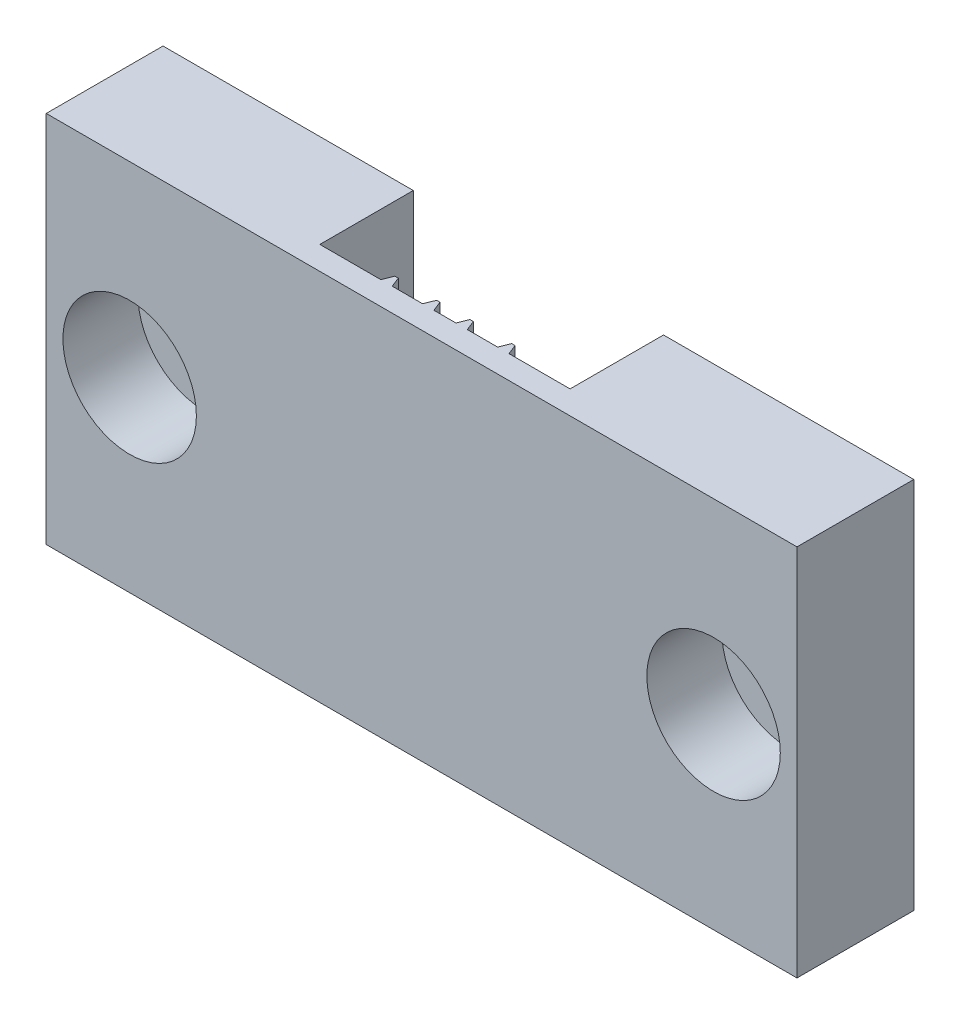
SolidWorks part; units mm, degrees
ref_plane "前视基准面" through (0, 0, 0) normal (0, 0, 1) x (1, 0, 0)
ref_plane "上视基准面" through (0, 0, 0) normal (0, 1, 0) x (1, 0, 0)
ref_plane "右视基准面" through (0, 0, 0) normal (1, 0, 0) x (0, 0, -1)
sketch "草图1" plane through (0, 0, 0) normal (0, 0, 1) x (1, 0, 0)
  line L0 (45, 0) -> (45, 22.38)
  line L1 (0, 0) -> (0, 22.38)
  line L2 (0, 0) -> (45, 0)
  line L3 (0, 22.38) -> (45, 22.38)
  circle A0 centre (5, 11.18) radius 2.25
  circle A1 centre (40, 11.18) radius 2.25
extrude "凸台-拉伸1" add sketch "草图1" along normal blind 7
sketch "草图2" plane through (0, 0, 7) normal (0, 0, 1) x (1, 0, 0)
  circle A0 centre (5, 11.18) radius 4
  circle A1 centre (40, 11.18) radius 4
extrude "切除-拉伸1" cut sketch "草图2" against normal blind 4.5
sketch "草图3" plane through (0, 22.38, 0) normal (0, 1, 0) x (1, 0, 0)
  line L0 (0, -7) -> (45, -7)
  line L1 (19.1, -5) -> (19.34, -5.6)
  line L2 (18.9, -5) -> (18.66, -5.6)
  line L3 (19.1, -5) -> (18.9, -5)
  line L4 (21.4, -5) -> (21.16, -5.6)
  line L5 (21.6, -5) -> (21.84, -5.6)
  line L7 (23.6, -5) -> (23.84, -5.6)
  line L8 (23.4, -5) -> (23.16, -5.6)
  line L9 (25.9, -5) -> (25.66, -5.6)
  line L10 (26.1, -5) -> (26.34, -5.6)
  line L11 (21.4, -5) -> (21.6, -5)
  line L12 (23.4, -5) -> (23.6, -5)
  line L13 (25.9, -5) -> (26.1, -5)
  line L14 (15, -5.6) -> (18.66, -5.6)
  line L15 (15, -5.6) -> (15, 0)
  line L16 (30, -5.6) -> (30, 0)
  line L17 (0, -7) -> (0, 0)
  line L18 (45, -7) -> (45, 0)
  line L19 (0, 0) -> (15, 0)
  line L20 (30, 0) -> (45, 0)
  line L21 (19.34, -5.6) -> (21.16, -5.6)
  line L22 (21.84, -5.6) -> (23.16, -5.6)
  line L23 (23.84, -5.6) -> (25.66, -5.6)
  line L24 (26.34, -5.6) -> (30, -5.6)
extrude "切除-拉伸2" cut sketch "草图3" against normal through all flip side to cut
